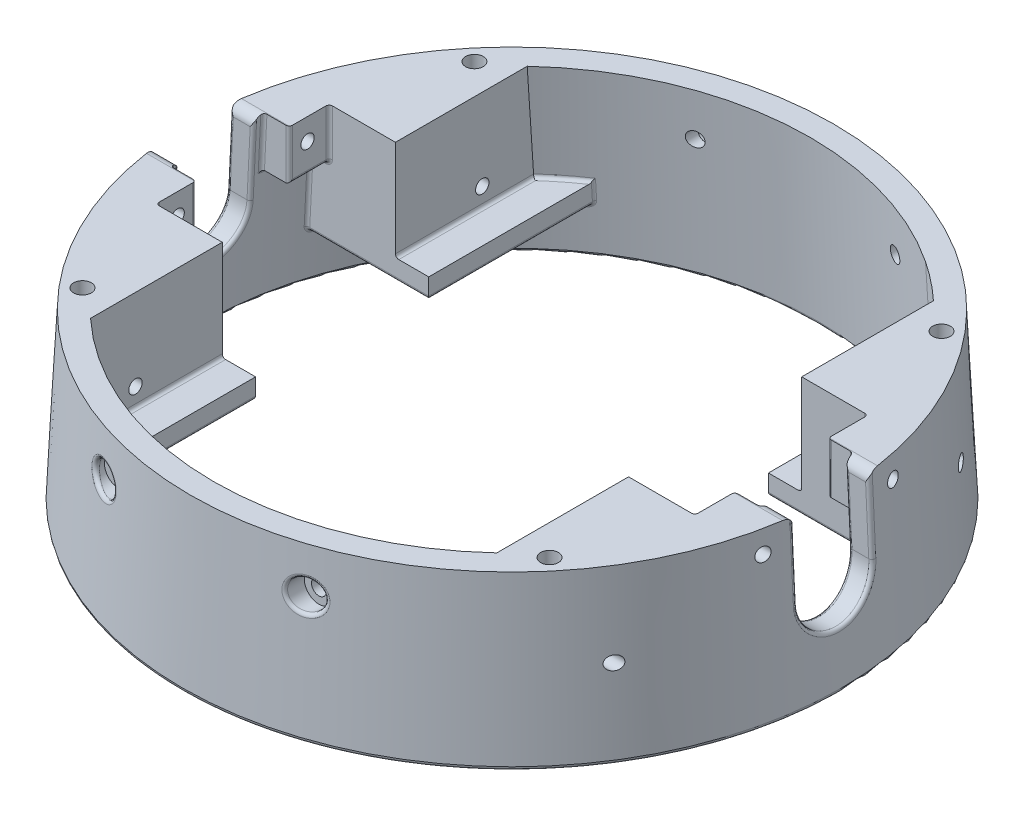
SolidWorks part; units mm, degrees
ref_plane "Front Plane" through (0, 0, 0) normal (0, 0, 1) x (1, 0, 0)
ref_plane "Top Plane" through (0, 0, 0) normal (0, 1, 0) x (1, 0, 0)
ref_plane "Right Plane" through (0, 0, 0) normal (1, 0, 0) x (0, 0, -1)
sketch "Sketch1" plane through (0, 0, 0) normal (0, 0, -1) x (-1, 0, 0)
  line L0 (-122.6312, 0) -> (-125.73, -63.5)
  line L1 (-125.73, -63.5) -> (-116.8294, -63.5)
  line L2 (-116.8294, -63.5) -> (-113.7306, 0)
  line L3 (-113.7306, 0) -> (-122.6312, 0)
  line L4 (0, 0) -> (0, -70.075) construction
  dimension "D1" = 245.2624
  dimension "D2" = 63.5
  dimension "D3" = 8.89
  dimension "D4" = 251.46
revolve "Revolve1" add sketch "Sketch1" angle 360 about L4
sketch "Sketch2" plane through (0, 0, 0) normal (1, 0, 0) x (0, 0, -1)
  line L0 (-14.2875, -28.575) -> (-14.2875, 0)
  line L1 (113.7306, 0) -> (-113.7306, 0) construction
  line L2 (-14.2875, 0) -> (14.2875, 0)
  line L3 (14.2875, 0) -> (14.2875, -28.575)
  line L4 (122.6312, 0) -> (-122.6312, 0) construction
  arc A0 (-14.2875, -28.575) -> (14.2875, -28.575) centre (0, -28.575) ccw
  dimension "D1" = 14.2875
  dimension "D2" = 28.575
extrude "Cut-Extrude1" cut sketch "Sketch2" against normal through all both and the other way through all
sketch "Sketch3" plane through (0, 0, 0) normal (0, 1, 0) x (1, 0, 0)
  line L0 (-118.102, -33.02) -> (-77.47, -33.02)
  line L1 (0, 0) -> (0, -139.2901) construction
  line L2 (-77.47, -33.02) -> (-77.47, -95.0621)
  line L3 (77.47, -33.02) -> (77.47, -95.0621)
  line L4 (77.47, -33.02) -> (118.102, -33.02)
  arc A1 (-118.102, -33.02) -> (-77.47, -95.0621) centre (0, 0) ccw
  arc A2 (-121.7961, -14.2875) -> (121.7961, -14.2875) centre (0, 0) ccw construction
  arc A4 (77.47, -95.0621) -> (118.102, -33.02) centre (0, 0) ccw
  dimension "D1" = 33.02
  dimension "D2" = 154.94
extrude "Boss-Extrude1" add sketch "Sketch3" against normal blind 6.35
sketch "Sketch4" plane through (0, 0, 33.02) normal (0, 0, -1) x (-1, 0, 0)
  line L0 (-83.82, -6.35) -> (-83.82, -45.72)
  line L1 (-108.8317, 0) -> (-77.47, 0) construction
  line L2 (-83.82, -45.72) -> (-64.77, -45.72)
  line L3 (-64.77, -45.72) -> (-64.77, -38.1)
  line L4 (-64.77, -38.1) -> (-77.47, -38.1)
  line L5 (-77.47, -38.1) -> (-77.47, -6.35)
  line L6 (-77.47, -6.35) -> (-83.82, -6.35)
  line L7 (0, 0) -> (0, -42.2286) construction
  line L8 (77.47, -6.35) -> (83.82, -6.35)
  line L9 (77.47, -38.1) -> (77.47, -6.35)
  line L10 (64.77, -38.1) -> (77.47, -38.1)
  line L11 (64.77, -45.72) -> (64.77, -38.1)
  line L12 (83.82, -45.72) -> (64.77, -45.72)
  line L13 (83.82, -6.35) -> (83.82, -45.72)
  line L14 (77.47, -6.35) -> (109.1555, -6.35) construction
  line L15 (-77.47, -6.35) -> (-77.47, 0) construction
  dimension "D1" = 38.1
  dimension "D2" = 6.35
  dimension "D3" = 7.62
  dimension "D4" = 12.7
extrude "Boss-Extrude2" add sketch "Sketch4" against normal up to next
sketch "Sketch11" plane through (0, -45.72, 0) normal (0, -1, 0) x (1, 0, 0)
  line L0 (-83.82, 59.7938) -> (-100.3684, 59.7938)
  line L1 (-83.82, 77.3269) -> (-83.82, 33.02) construction
  line L2 (-83.82, 59.7938) -> (-83.82, 81.3838)
  line L3 (-83.82, 80.1332) -> (-83.82, 33.02) construction
  line L4 (0, 0) -> (0, 57.8307) construction
  line L5 (83.82, 59.7938) -> (83.82, 81.3838)
  line L6 (83.82, 59.7938) -> (100.3684, 59.7938)
  circle A0 centre (0, 0) radius 116.8294 construction
  arc A1 (-100.3684, 59.7938) -> (-83.82, 81.3838) centre (0, 0) cw
  arc A2 (100.3684, 59.7938) -> (83.82, 81.3838) centre (0, 0) ccw
  dimension "D1" = 21.59
extrude "Boss-Extrude4" add sketch "Sketch11" against normal up to surface (39.37 mm away)
fillet "Fillet1" radius 3.175 4 edges at (-83.82, -26.035, 59.7938) (83.82, -26.035, 59.7938)
sketch "Sketch8" plane through (0, 0, 33.02) normal (0, 0, -1) x (-1, 0, 0)
  line L0 (-83.82, 0) -> (-83.82, -45.72)
  line L1 (-83.82, -45.72) -> (-115.9618, -45.72)
  line L2 (-116.8294, -63.5) -> (-113.7306, 0) construction
  line L3 (-115.9618, -45.72) -> (-113.7306, 0)
  line L4 (-113.7306, 0) -> (-83.82, 0)
  line L5 (108.8317, 0) -> (77.47, 0) construction
  line L6 (-83.82, -45.72) -> (-64.77, -45.72) construction
  line L7 (-83.82, -6.35) -> (-83.82, -45.72) construction
  line L8 (0, 0) -> (0, -79.8686) construction
  line L9 (113.7306, 0) -> (83.82, 0)
  line L10 (115.9618, -45.72) -> (113.7306, 0)
  line L11 (83.82, -45.72) -> (115.9618, -45.72)
  line L12 (83.82, 0) -> (83.82, -45.72)
extrude "Boss-Extrude3" add sketch "Sketch8" against normal blind 6.35
ref_plane "Plane1" through (0, 0, 127) normal (0, 0, 1) x (1, 0, 0)
hole_wizard "CBORE for #10 Binding Head Machine Screw1" positions "Sketch12" profile "Sketch13" counterbore size "#10" standard "ANSI Inch"
sketch "Sketch12" plane through (0, 0, 127) normal (0, 0, 1) x (1, 0, 0)
  line L0 (0, 0) -> (0, -75.9111) construction
  circle A1 centre (-38.1, -16.8275) radius 3.5719 construction
  point P0 (-38.1, -16.8275)
  point P12 (38.1, -16.8275)
sketch "Sketch13" plane through (-38.1, -16.8275, 127) normal (1, 0, 0) x (0, -1, 0)
  line L0 (0, 0) -> (0, 52.4864)
  line L1 (0, 52.4864) -> (2.8067, 50.8)
  line L2 (2.8067, 50.8) -> (2.8067, 15.24)
  line L3 (2.8067, 15.24) -> (5.5562, 15.24)
  line L4 (5.5562, 15.24) -> (5.5562, 0)
  line L5 (5.5562, 0) -> (0, 0)
  line L10 (0, 52.4864) -> (-2.8067, 50.8) construction
  line L11 (0, -6.35) -> (0, 107.95) construction
  dimension "Hole Dia." = 5.6134
  dimension "Hole Depth" = 50.8
  dimension "C'Bore Dia." = 11.1125
  dimension "C'Bore Depth" = 15.24
  dimension "Drill Angle" = 118
sketch "Sketch14" plane through (0, 0, 0) normal (0, -1, 0) x (1, 0, 0)
  line L0 (111.1612, 33.02) -> (64.77, 33.02) construction
  line L1 (102.7461, 33.02) -> (115.4685, 33.02)
  line L2 (102.7461, 33.02) -> (102.7461, 17.78)
  line L3 (102.7461, 17.78) -> (115.4685, 17.78)
  line L4 (115.4685, 33.02) -> (115.4685, 17.78)
  line L5 (0, 0) -> (0, 61.0562) construction
  line L6 (-115.4685, 33.02) -> (-115.4685, 17.78)
  line L7 (-102.7461, 17.78) -> (-115.4685, 17.78)
  line L8 (-102.7461, 33.02) -> (-102.7461, 17.78)
  line L9 (-102.7461, 33.02) -> (-115.4685, 33.02)
  circle A0 centre (0, 0) radius 116.8294 construction
  dimension "D1" = 15.24
  dimension "D2" = 19.05
extrude "Boss-Extrude5" add sketch "Sketch14" along normal blind 19.05
mirror "Mirror3" about plane through (0, 0, 0) normal (0, 0, 1) of "Boss-Extrude5", "Fillet1", "Boss-Extrude4", "Boss-Extrude1", "Boss-Extrude2", "Boss-Extrude3", "CBORE for #10 Binding Head Machine Screw1"
hole_wizard "17/64 (0.26563) Diameter Hole1" positions "Sketch9" profile "Sketch10" hole size "17/64" standard "ANSI Inch"
sketch "Sketch9" plane through (0, 0, 0) normal (0, 1, 0) x (1, 0, 0)
  point P0 (-89.0668, -74.736)
  point P3 (89.0668, -74.736)
  point P6 (89.0668, 74.736)
  point P9 (-89.0668, 74.736)
sketch "Sketch10" plane through (-89.0668, 0, 74.736) normal (1, 0, 0) x (0, 0, 1)
  line L0 (0, 0) -> (0, 54.1031)
  line L1 (0, 54.1031) -> (3.3735, 48.26)
  line L2 (3.3735, 48.26) -> (3.3735, 0)
  line L5 (3.3735, 0) -> (0, 0)
  line L10 (0, 54.1031) -> (-3.3735, 48.26) construction
  line L11 (0, -6.35) -> (0, 107.95) construction
  dimension "Hole Dia." = 6.747
  dimension "Hole Depth" = 48.26
  dimension "Drill Angle" = 60
fillet "Fillet3" radius 1.27 18 edges at (-124.7071, -42.7655, 1.6619) (124.7071, -42.7655, -1.6619) (0, -63.5, 125.73) (0, -63.5, 116.8294) (42.9529, -14.1217, -115.5983) (-41.2746, -12.2675, -116.112) (-35.4982, -11.9181, 117.9884) (40.78, -11.9603, 116.2708) (115.8057, -42.766, 1.6579) (-115.8057, -42.766, -1.6579)
fillet "Fillet5" radius 1.27 20 edges at (-102.7461, -9.525, -17.78) (-102.7461, -9.525, 17.78) (102.7461, -9.525, 17.78) (102.7461, -9.525, -17.78) (102.7461, -9.525, 33.02) (102.7461, -9.525, -33.02) (102.7461, -19.05, -25.4) (102.7461, -19.05, 25.4) (-102.7461, -9.525, 33.02) (-102.7461, -9.525, -33.02) (-102.7461, -19.05, -25.4) (-102.7461, -19.05, 25.4) (106.2744, -19.05, 33.02) (106.2744, -19.05, -33.02) (-106.2744, -19.05, 33.02) (-106.2744, -19.05, -33.02)
fillet "Fillet6" radius 1.27 8 edges at (71.2938, -38.1, 90.9847) (-71.2938, -38.1, 90.9847) (-77.47, -38.1, 59.4035) (77.47, -38.1, 59.4035) (77.47, -38.1, -59.4035) (71.2938, -38.1, -90.9847) (-71.2938, -38.1, -90.9847) (-77.47, -38.1, -59.4035)
fillet "Fillet9" radius 1.27 32 edges at (84.7499, -6.35, 58.8639) (91.1542, -6.35, 59.7938) (97.3574, -6.35, 59.0511) (102.972, -6.35, 49.0103) (95.4246, -6.35, 39.37) (83.82, -6.35, 47.9944) (-102.972, -6.35, 49.0103) (-96.3673, -6.35, 59.6144) (-91.1542, -6.35, 59.7938) (-84.7499, -6.35, 58.8639) (-83.82, -6.35, 47.9944) (-95.4246, -6.35, 39.37) (-83.82, -6.35, -47.9944) (-84.7499, -6.35, -58.8639) (-91.1542, -6.35, -59.7938) (-97.3574, -6.35, -59.0511) (-102.972, -6.35, -49.0103) (-95.4246, -6.35, -39.37) (96.3673, -6.35, -59.6144) (91.1542, -6.35, -59.7938) (84.7499, -6.35, -58.8639) (83.82, -6.35, -47.9944) (95.4246, -6.35, -39.37) (102.972, -6.35, -49.0103) (83.82, -26.035, 39.37) (-83.82, -26.035, 39.37) (-83.82, -26.035, -39.37) (83.82, -26.035, -39.37)
fillet "Fillet10" radius 1.27 28 edges at (-99.6098, -45.72, 59.0304) (-92.2682, -45.72, 59.7938) (-84.7499, -45.72, 58.8639) (-108.3277, -45.72, 39.9681) (-96.1693, -45.72, 39.37) (-84.192, -45.72, 39.742) (-98.5952, -45.72, -59.6144) (-92.2682, -45.72, -59.7938) (-84.7499, -45.72, -58.8639) (-108.2617, -45.72, -39.8725) (-96.1693, -45.72, -39.37) (-84.192, -45.72, -39.742) (99.6098, -45.72, -59.0304) (92.2682, -45.72, -59.7938) (84.7499, -45.72, -58.8639) (108.3277, -45.72, -39.9681) (96.1693, -45.72, -39.37) (84.192, -45.72, -39.742) (108.2617, -45.72, 39.8725) (96.1693, -45.72, 39.37) (84.192, -45.72, 39.742) (83.82, -45.72, 48.6294) (84.7499, -45.72, 58.8639) (98.5952, -45.72, 59.6144) (-83.82, -45.72, 48.6294) (-83.82, -45.72, -48.6294) (83.82, -45.72, -48.6294) (92.2682, -45.72, 59.7938)
fillet "Fillet11" radius 1.27 12 edges at (-109.9537, -19.346, 32.565) (-109.9053, -19.5549, -32.7636) (109.9537, -19.346, -32.565) (109.9053, -19.5549, 32.7636) (-112.0607, -19.05, 24.2772) (-112.0607, -19.05, -24.2772) (112.0607, -19.05, -24.2772) (112.0607, -19.05, 24.2772)
fillet "Fillet12" radius 1.27 36 edges at (99.2309, -45.5433, 59.9863) (108.9612, -45.6112, 39.6656) (111.0031, -45.72, 32.7411) (-108.9612, -45.6112, 39.6656) (-99.2309, -45.5433, 59.9863) (-110.9431, -45.72, 32.7863) (-99.2309, -45.5433, -59.9863) (-108.9612, -45.6112, -39.6656) (108.9612, -45.6112, -39.6656) (-111.0031, -45.72, -32.7411) (99.2309, -45.5433, -59.9863) (110.9431, -45.72, -32.7863) (76.3047, -45.72, 87.3196) (94.9793, -45.72, 66.5287) (110.3609, -45.72, 35.6034) (87.489, -45.72, 33.02) (64.77, -45.72, 64.6036) (-110.3609, -45.72, 35.6034) (-76.3047, -45.72, 87.3196) (-94.9793, -45.72, 66.5287) (-64.77, -45.72, 64.6036) (-87.489, -45.72, 33.02) (-76.3047, -45.72, -87.3196) (-94.9793, -45.72, -66.5287) (-110.3609, -45.72, -35.6034) (110.3609, -45.72, -35.6034) (-87.489, -45.72, -33.02) (-64.77, -45.72, -64.6036) (94.9793, -45.72, -66.5287) (76.3047, -45.72, -87.3196) (64.77, -45.72, -64.6036) (87.489, -45.72, -33.02)
hole_wizard "1/4-20 Tapped Hole1" positions "Sketch15" profile "Sketch16" tap size "1/4-20" standard "ANSI Inch"
sketch "Sketch15" plane through (77.47, 0, 0) normal (-1, 0, 0) x (0, 0, 1)
  circle A2 centre (24.7778, -8.224) radius 3.5719 construction
  circle A3 centre (-24.7778, -8.224) radius 3.5719 construction
  point P0 (24.7778, -8.224)
  point P2 (-24.7778, -8.224)
  point P17 (-66.1292, -31.084)
  point P20 (66.1292, -31.084)
sketch "Sketch16" plane through (77.47, -8.224, 24.7778) normal (0, 1, 0) x (0, 0, 1)
  line L0 (0, 0) -> (0, 52.3338)
  line L1 (0, 52.3338) -> (2.5527, 50.8)
  line L2 (2.5527, 50.8) -> (2.5527, 0)
  line L5 (2.5527, 0) -> (0, 0)
  line L10 (0, 52.3338) -> (-2.5527, 50.8) construction
  line L11 (0, -6.35) -> (0, 107.95) construction
  dimension "Tap Drill Dia." = 5.1054
  dimension "Tap Drill Depth" = 50.8
  dimension "Drill Angle" = 118
mirror "Mirror6" about plane through (0, 0, 0) normal (1, 0, 0) of "1/4-20 Tapped Hole1"
fillet "Fillet8" radius 3.81 4 edges at (117.1517, 0, -14.2875) (117.1517, 0, 14.2875) (-117.1517, 0, -14.2875) (-117.1517, 0, 14.2875)
fillet "Fillet13" radius 1.27 28 edges at (-90.5724, -45.9844, -71.717) (-86.4681, -46.1537, -76.887) (86.3552, -45.9844, -76.7428) (90.7339, -46.1537, -71.8032) (86.4681, -46.1537, 76.887) (90.5724, -45.9844, 71.717) (-90.7339, -46.1537, 71.8032) (-86.3552, -45.9844, 76.7428) (-91.6511, -48.26, -76.9044) (-86.4826, -45.72, -72.5675) (-89.1507, -53.9369, -74.7827) (91.6511, -48.26, -76.9044) (86.4826, -45.72, -72.5675) (89.1274, -53.9369, -74.8104) (91.6511, -48.26, 76.9044) (86.4826, -45.72, 72.5675) (89.1507, -53.9369, 74.7827) (-91.6511, -48.26, 76.9044) (-86.4826, -45.72, 72.5675) (-89.1274, -53.9369, 74.8104)
